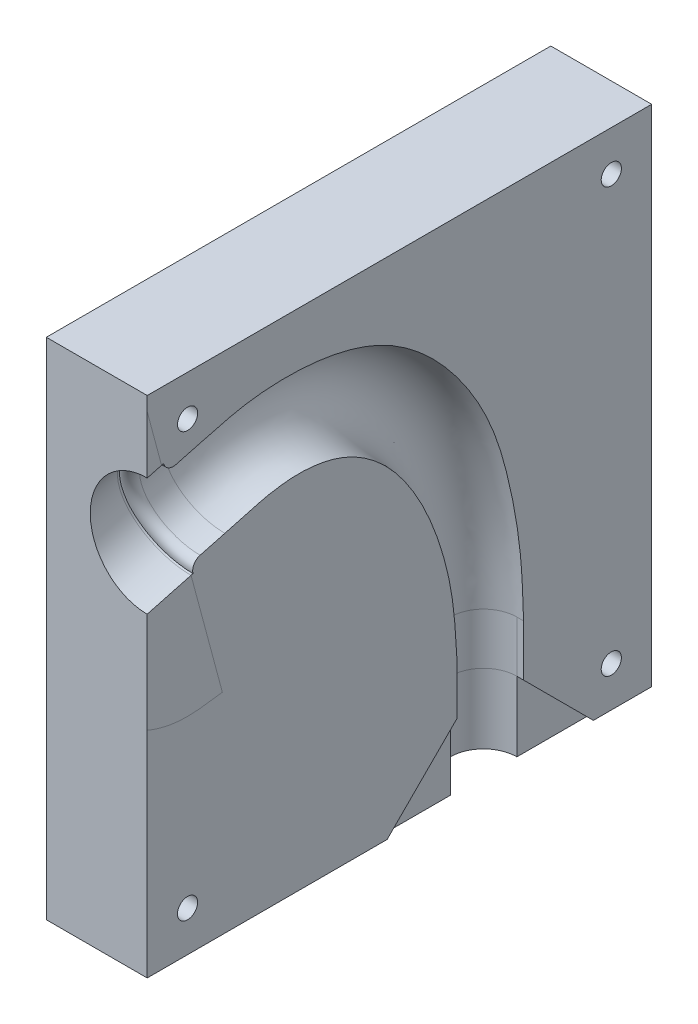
SolidWorks part; units mm, degrees
other "<runner-Cav_1>-<Stock-runner-1>"
ref_plane "Front Plane" through (0, 0, 0) normal (0, 0, 1) x (1, 0, 0)
ref_plane "Top Plane" through (0, 0, 0) normal (0, 1, 0) x (1, 0, 0)
ref_plane "Right Plane" through (0, 0, 0) normal (1, 0, 0) x (0, 0, -1)
ref_plane "Front Plane-runner-Cav_1_Mirrored" through (0, 0, 0) normal (0, 0, 1) x (-1, 0, 0)
ref_plane "Top Plane-runner-Cav_1_Mirrored" through (0, 0, 0) normal (0, 1, 0) x (-1, 0, 0)
ref_plane "Right Plane-runner-Cav_1_Mirrored" through (0, 0, 0) normal (-1, 0, 0) x (0, 0, -1)
mirrored part "runner-Cav_1_Mirrored"
